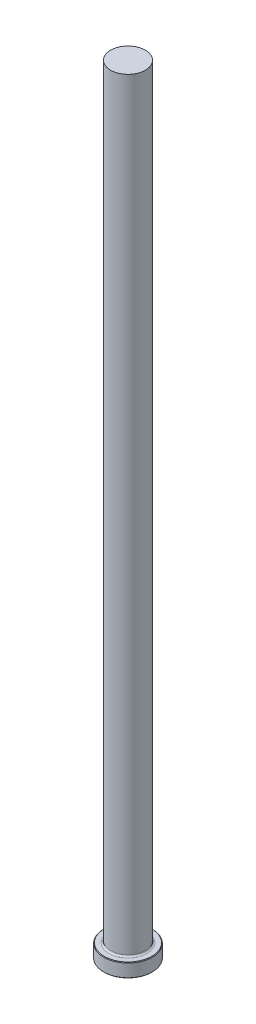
SolidWorks part; units mm, degrees
ref_plane "Front Plane" through (0, 0, 0) normal (0, 0, 1) x (1, 0, 0)
ref_plane "Top Plane" through (0, 0, 0) normal (0, 1, 0) x (1, 0, 0)
ref_plane "Right Plane" through (0, 0, 0) normal (1, 0, 0) x (0, 0, -1)
sketch "Sketch1" plane through (0, 0, 0) normal (0, 0, 1) x (1, 0, 0)
  line L0 (0, 259.9588) -> (0, -15.1925) construction
  line L1 (0, 0) -> (-11.1125, 0)
  line L2 (-11.1125, 0) -> (-11.1125, 6.35)
  line L3 (-11.1125, 6.35) -> (-7.9375, 6.35)
  line L4 (-7.9375, 6.35) -> (-7.9375, 355.6)
  line L5 (-7.9375, 355.6) -> (0, 355.6)
  line L6 (0, 355.6) -> (0, 0)
  dimension "L" = 355.6
  dimension "H" = 22.225
  dimension "T" = 6.35
  dimension "D" = 15.875
revolve "Revolve1" add sketch "Sketch1" angle 360 about L0
chamfer "Chamfer1" distance 0.254 angle 45 2 edges at (0, 6.35, 11.1125) (0, 0, 11.1125)
fillet "Fillet1" radius 0.762 1 edges at (0, 6.35, 7.9375)
sketch "Pocket Sketch" plane through (0, 0, 0) normal (0, 0, 1) x (1, 0, 0)
  line L0 (-11.5094, 0) -> (-11.5094, 6.3754)
  line L1 (-11.5094, 6.3754) -> (-9.0964, 6.3754)
  line L2 (-8.3344, 7.1374) -> (-8.3344, 22.225)
  line L3 (-8.3344, 22.225) -> (0, 22.225)
  line L4 (0, 22.225) -> (0, 0)
  line L5 (0, 0) -> (-11.5094, 0)
  line L6 (0, 12.6104) -> (0, -2.4989) construction
  line L7 (-11.1125, 6.096) -> (-11.1125, 0.254) construction
  line L8 (10.8585, 6.35) -> (-10.8585, 6.35) construction
  line L9 (-7.9375, 355.6) -> (-7.9375, 7.112) construction
  line L10 (-9.0964, 6.3754) -> (-8.3344, 7.1374)
  point P3 (-8.3344, 6.3754)
  dimension "D1" = 23.0187
  dimension "D2" = 0.3969
  dimension "D3" = 0.0254
  dimension "D4" = 0.3969
  dimension "D5" = 16.6687
  dimension "D6" = 22.225
